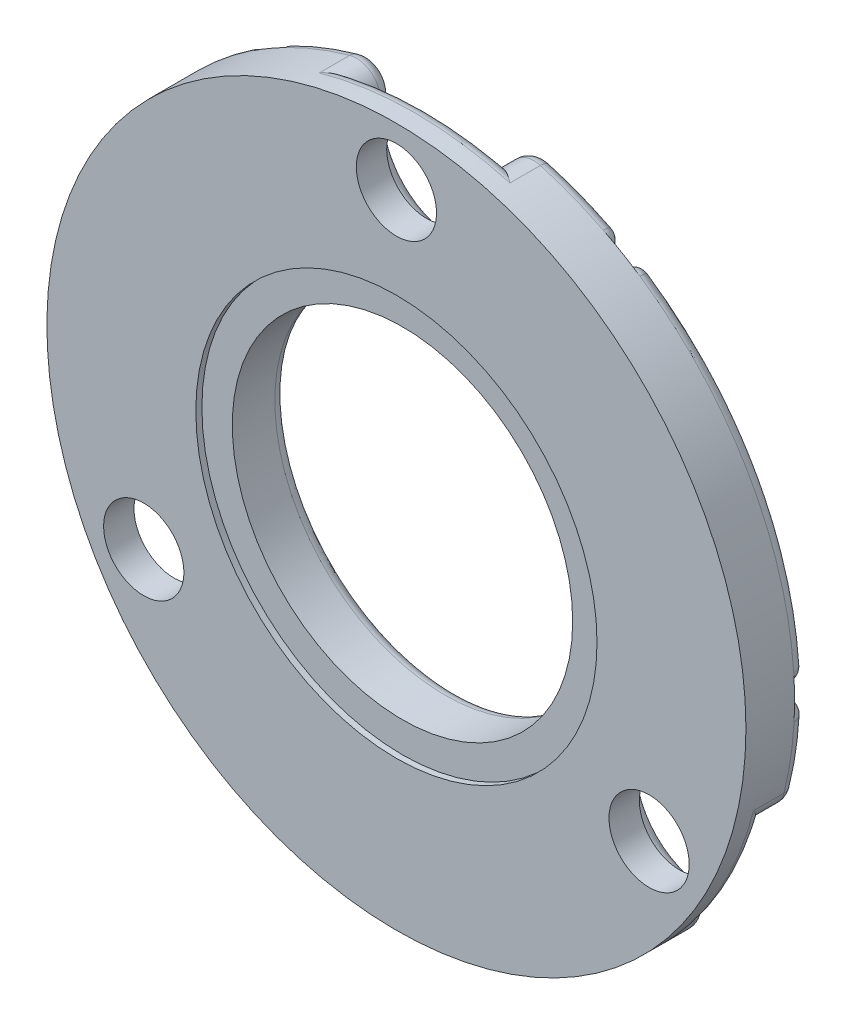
SolidWorks part; units mm, degrees
ref_plane "前视基准面" through (0, 0, 0) normal (0, 0, 1) x (1, 0, 0)
ref_plane "上视基准面" through (0, 0, 0) normal (0, 1, 0) x (1, 0, 0)
ref_plane "右视基准面" through (0, 0, 0) normal (1, 0, 0) x (0, 0, -1)
sketch "草图1" plane through (0, 0, 0) normal (0, 0, 1) x (1, 0, 0)
  circle A0 centre (0, 0) radius 28.75
  circle A1 centre (0, 0) radius 14
  dimension "D1" = 28
  dimension "D2" = 57.5
extrude "凸台-拉伸1" add sketch "草图1" along normal blind 5
hole_wizard "打孔尺寸根据内六角圆柱头螺钉的类型1" positions "草图3" profile "草图2" counterbore size "M6" standard "Gb"
sketch "草图3" plane through (0, 0, 0) normal (0, 0, -1) x (-1, 0, 0)
  line L0 (0, 0) -> (41.2466, 0) construction
  line L2 (0, 0) -> (0, 24) construction
  line L3 (0, 0) -> (20.7846, -12) construction
  line L4 (0, 0) -> (-20.7846, -12) construction
  point P0 (0, 24)
  point P25 (20.7846, -12)
  point P27 (-20.7846, -12)
  dimension "D1" = 24
  dimension "D2" = 3
sketch "草图2" plane through (0, 24, 0) normal (1, 0, 0) x (0, 1, 0)
  line L0 (0, 0) -> (0, 5)
  line L1 (0, 5) -> (3.3, 5)
  line L3 (3.3, 5) -> (3.3, 2.5)
  line L4 (3.3, 2.5) -> (5.5, 2.5)
  line L5 (5.5, 2.5) -> (5.5, 0)
  line L7 (5.5, 0) -> (0, 0)
  line L11 (0, -6.35) -> (0, 107.95) construction
  dimension "Í¨¿×¿×Ö±¾¶" = 6.6
  dimension "Í¨¿×¿×Éî¶È" = 5
  dimension "ÖùÐÎ³ÁÍ·¿×Ö±¾¶" = 11
  dimension "ÖùÐÎ³ÁÍ·¿×Éî¶È" = 2.5
fillet "圆角1" radius 2 6 edges at (23.2443, -16.9193, 1.25) (26.2747, -11.6705, 1.25) (-26.2747, -11.6705, 1.25) (-23.2443, -16.9193, 1.25) (3.0304, 28.5898, 1.25) (-3.0304, 28.5898, 1.25)
fillet "圆角2" radius 1 16 edges at (5.9127, 27.1798, 0) (24.8982, 14.375, 0) (26.4947, -8.4693, 0) (16.0215, -9.25, 0) (20.582, -18.7104, 0) (0, -28.75, 0) (-20.582, -18.7104, 0) (-16.0215, -9.25, 0) (-26.4947, -8.4693, 0) (-24.8982, 14.375, 0) (-5.9127, 27.1798, 0) (0, 18.5, 0) (24.8982, -14.375, 2.5) (-24.8982, -14.375, 2.5) (0, 28.75, 2.5) (14, 0, 0)
sketch "草图4" plane through (0, 0, 0) normal (0, 0, -1) x (-1, 0, 0)
  line L0 (0, 0) -> (-24.8982, 14.375) construction
  line L1 (0, 0) -> (24.8982, 14.375) construction
  line L2 (0, 0) -> (0, -28.75) construction
  arc A0 (-7.8419, 27.6598) -> (-27.8751, -7.0386) centre (0, 0) ccw construction
  circle A1 centre (-38.9711, 22.5) radius 25
  circle A2 centre (38.9711, 22.5) radius 25
  circle A3 centre (0, -45) radius 25
  point P17 (0, 0)
  dimension "D1" = 50
  dimension "D2" = 45
  dimension "D3" = 3
extrude "切除-拉伸-薄壁1" cut sketch "草图4" against normal blind 1 thin
fillet "圆角3" radius 1 18 edges at (-14.0044, -24.8971, 0.4212) (13.9037, -24.8273, 0.2912) (14.8524, -24.2718, 0.2913) (-14.9425, -24.3367, 0.4107) (-13.605, 25.1089, 0.4107) (-28.4462, -0.7266, 0.2913) (-28.4529, 0.3727, 0.2912) (-14.5593, 24.5767, 0.4212) (13.5938, 24.9985, 0.2913) (28.5474, -0.7722, 0.4107) (28.5637, 0.3204, 0.4212) (14.5492, 24.4546, 0.2912) (0, -20.5, 0) (0, -19.5, 0) (-16.8875, 9.75, 0) (-17.7535, 10.25, 0) (16.8875, 9.75, 0) (17.7535, 10.25, 0)
sketch "草图5" plane through (0, 0, 5) normal (0, 0, 1) x (1, 0, 0)
  circle A0 centre (0, 0) radius 16.5
  dimension "D1" = 33
extrude "切除-拉伸1" cut sketch "草图5" against normal blind 0.5
